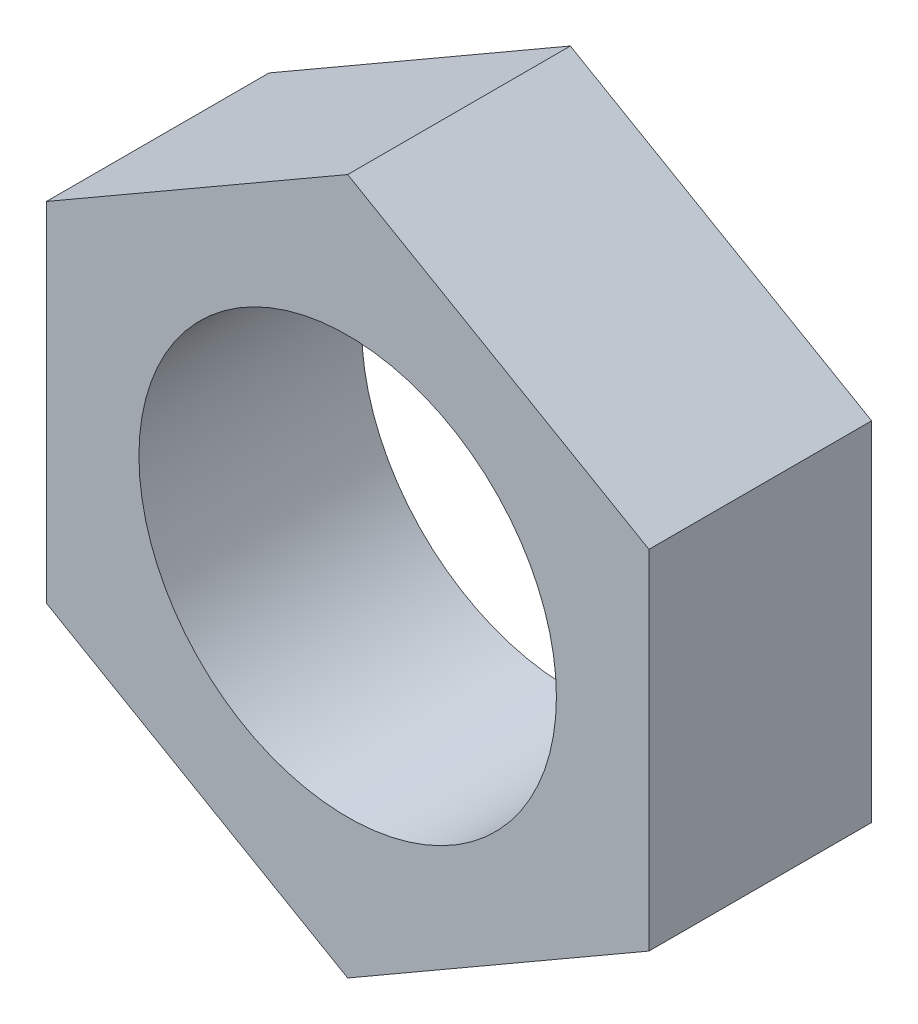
SolidWorks part; units mm, degrees
ref_plane "Alzado" through (0, 0, 0) normal (0, 0, 1) x (1, 0, 0)
ref_plane "Planta" through (0, 0, 0) normal (0, 1, 0) x (1, 0, 0)
ref_plane "Vista lateral" through (0, 0, 0) normal (1, 0, 0) x (0, 0, -1)
sketch "Croquis1" plane through (0, 0, 0) normal (0, 0, 1) x (1, 0, 0)
  line L1 (0, 12.5) -> (-10.8253, 6.25)
  line L2 (-10.8253, 6.25) -> (-10.8253, -6.25)
  line L3 (-10.8253, -6.25) -> (0, -12.5)
  line L4 (0, -12.5) -> (10.8253, -6.25)
  line L5 (10.8253, -6.25) -> (10.8253, 6.25)
  line L6 (10.8253, 6.25) -> (0, 12.5)
  circle A0 centre (0, 0) radius 7.5
  circle A2 centre (0, 0) radius 10.8253 construction
  dimension "D1" = 15
  dimension "D2" = 12.5
extrude "Saliente-Extruir1" add sketch "Croquis1" along normal blind 8
